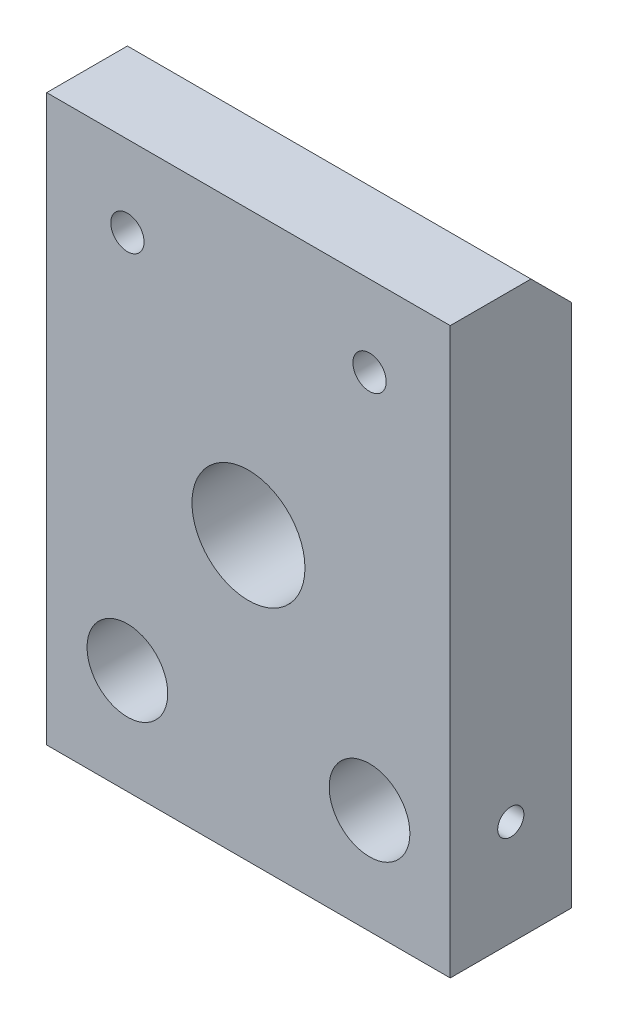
SolidWorks part; units mm, degrees
ref_plane "Plan1" through (0, 0, 0) normal (0, 0, 1) x (1, 0, 0)
ref_plane "plan2" through (0, 0, 0) normal (0, 1, 0) x (1, 0, 0)
ref_plane "Plan3" through (0, 0, 0) normal (1, 0, 0) x (0, 0, -1)
sketch "Esquisse1" plane through (0, 0, 0) normal (0, 0, 1) x (1, 0, 0)
  line L0 (0, 0) -> (0, 105) construction
  line L1 (-25, 0) -> (25, 0)
  line L2 (25, 0) -> (25, 70)
  line L3 (-25, 0) -> (-25, 70)
  line L4 (25, 70) -> (-25, 70)
  circle A0 centre (15, 13) radius 5
  circle A1 centre (-15, 13) radius 5
  circle A2 centre (0, 35) radius 7
  circle A3 centre (-15, 60) radius 2.065
  circle A4 centre (15, 60) radius 2.065
  point P5 (0, 0)
  point P9 (0, 70)
  dimension "D8" = 4.13
  dimension "D9" = 10
  dimension "D10" = 14
  dimension "D1" = 50
  dimension "D2" = 70
  dimension "D3" = 13
  dimension "D4" = 10
  dimension "D5" = 10
  dimension "D6" = 35
  dimension "D7" = 60
extrude "Base-Extrusion" add sketch "Esquisse1" along normal blind 15
chamfer "Chanfrein3" distance 5 angle 45
sketch "Esquisse10" plane through (25, 0, 0) normal (1, 0, 0) x (0, 0, -1)
  line L0 (-15, 0) -> (0, 0) construction
  line L1 (-15, 0) -> (-15, 70) construction
  circle A0 centre (-7.5, 13) radius 1.62
  dimension "D3" = 3.24
  dimension "D1" = 13
  dimension "D2" = 7.5
extrude "Enlèv. mat.-Extru.1" cut sketch "Esquisse10" against normal up to next
mirror "Symétrie1" about plane through (0, 0, 0) normal (1, 0, 0)
